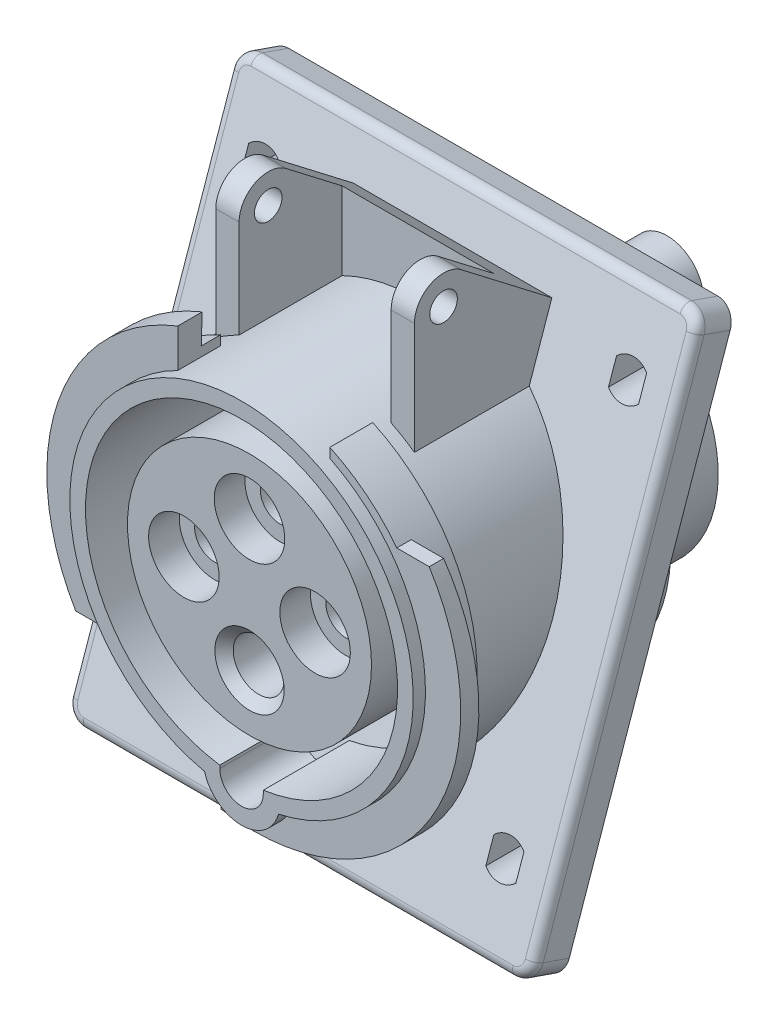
SolidWorks part; units mm, degrees
ref_plane "Спереди" through (0, 0, 0) normal (0, 0, 1) x (1, 0, 0)
ref_plane "Сверху" through (0, 0, 0) normal (0, 1, 0) x (1, 0, 0)
ref_plane "Справа" through (0, 0, 0) normal (1, 0, 0) x (0, 0, -1)
sketch "Эскиз1" plane through (0, 0, 0) normal (0, 0, 1) x (1, 0, 0)
  line L0 (-30.35, 30.35) -> (-30.35, -30.35) construction
  line L1 (-37.25, -37.25) -> (37.25, -37.25)
  line L2 (-37.25, -37.25) -> (-37.25, 37.25)
  line L3 (-37.25, 37.25) -> (37.25, 37.25)
  line L4 (37.25, -37.25) -> (37.25, 37.25)
  line L5 (-37.25, -37.25) -> (37.25, 37.25) construction
  line L6 (-37.25, 37.25) -> (37.25, -37.25) construction
  line L7 (-30.35, -30.35) -> (30.35, -30.35) construction
  line L8 (30.35, -30.35) -> (30.35, 30.35) construction
  line L9 (30.35, 30.35) -> (-30.35, 30.35) construction
  circle A0 centre (-30.35, 30.35) radius 2.4
  circle A1 centre (30.35, 30.35) radius 2.4
  circle A2 centre (30.35, -30.35) radius 2.4
  circle A3 centre (-30.35, -30.35) radius 2.4
  point P0 (0, 0)
  dimension "D3" = 4.8
  dimension "D1" = 74.5
  dimension "D2" = 74.5
  dimension "D4" = 60.7
extrude "Бобышка-Вытянуть1" add sketch "Эскиз1" along normal blind 9.8
sketch "Эскиз2" plane through (0, 0, 9.8) normal (0, 0, 1) x (1, 0, 0)
  circle A0 centre (0, 0) radius 28
  dimension "D1" = 56
extrude "Бобышка-Вытянуть2" add sketch "Эскиз2" along normal blind 40.7
sketch "Эскиз3" plane through (0, 0, 50.5) normal (0, 0, 1) x (1, 0, 0)
  circle A0 centre (0, 0) radius 25.45
  circle A1 centre (0, 0) radius 19.9
  dimension "D1" = 50.9
  dimension "D2" = 39.8
extrude "Вырез-Вытянуть1" cut sketch "Эскиз3" against normal blind 39
sketch "Эскиз4" plane through (0, 0, 50.5) normal (0, 0, 1) x (1, 0, 0)
  circle A0 centre (0, 0) radius 22.65
  dimension "D1" = 45.3
extrude "Вырез-Вытянуть2" cut sketch "Эскиз4" against normal blind 1.3
sketch "Эскиз5" plane through (0, 0, 49.2) normal (0, 0, 1) x (1, 0, 0)
  line L0 (0, 0) -> (0, -10.7) construction
  circle A0 centre (0, -10.7) radius 4.15
  circle A13 centre (0, 10.7) radius 5.75
  circle A14 centre (-10.7, 0) radius 5.75
  circle A15 centre (10.7, 0) radius 5.75
  point P15 (0, 0)
  point P18 (0, 0)
  dimension "D1" = 8.3
  dimension "D4" = 10.7
  dimension "D2" = 11.5
  dimension "D3" = 10.7
  dimension "D5" = 10.7
  dimension "D6" = 10.7
extrude "Вырез-Вытянуть3" cut sketch "Эскиз5" against normal blind 5
sketch "Эскиз6" plane through (0, 0, 44.2) normal (0, 0, 1) x (1, 0, 0)
  circle A0 centre (0, 10.7) radius 3.25
  circle A1 centre (-10.7, 0) radius 3.25
  circle A2 centre (10.7, 0) radius 3.25
  circle A4 centre (0, -10.7) radius 4.15
  dimension "D1" = 6.5
  dimension "D2" = 8.3
extrude "Вырез-Вытянуть4" cut sketch "Эскиз6" against normal blind 20
chamfer "Фаска1" distance 1.5 angle 45 1 edges at (4.15, -10.7, 49.2)
sketch "Эскиз7" plane through (0, 0, 9.8) normal (0, 0, 1) x (1, 0, 0)
  arc A0 (-6.0271, -27.3436) -> (6.0271, -27.3436) centre (0, -25.6893) ccw
  circle A4 centre (0, 0) radius 28 construction
  arc A5 (-6.0271, -27.3436) -> (6.0271, -27.3436) centre (0, 0) ccw
  point P4 (0, -31.9393)
  dimension "D1" = 12.5
extrude "Бобышка-Вытянуть3" add sketch "Эскиз7" along normal up to surface (40.7 mm away)
sketch "Эскиз8" plane through (0, 0, 50.5) normal (0, 0, 1) x (1, 0, 0)
  line L0 (-3.55, -25.6893) -> (-3.55, -25.2012)
  line L1 (3.55, -25.6893) -> (3.55, -25.2012)
  circle A1 centre (0, 0) radius 25.45 construction
  arc A2 (-3.4234, -26.629) -> (3.4234, -26.629) centre (0, -25.6893) ccw
  arc A3 (-3.55, -25.6893) -> (3.55, -25.6893) centre (0, -25.6893) ccw
  arc A4 (-3.55, -25.2012) -> (3.55, -25.2012) centre (0, 0) ccw
  dimension "D1" = 2.7
extrude "Вырез-Вытянуть5" cut sketch "Эскиз8" against normal up to surface (39 mm away)
ref_plane "Плоскость1" through (0, 0, 48.5) normal (0, 0, 1) x (1, 0, 0)
sketch "Эскиз9" plane through (0, 0, 48.5) normal (0, 0, 1) x (1, 0, 0)
  circle A0 centre (0, 0) radius 33.75
  arc A1 (-6.0271, -27.3436) -> (6.0271, -27.3436) centre (0, -25.6893) ccw construction
  arc A2 (6.0271, -27.3436) -> (-6.0271, -27.3436) centre (0, 0) ccw construction
  arc A3 (-6.0271, -27.3436) -> (6.0271, -27.3436) centre (0, -25.6893) ccw
  arc A4 (6.0271, -27.3436) -> (-6.0271, -27.3436) centre (0, 0) ccw
  dimension "D1" = 67.5
extrude "Бобышка-Вытянуть4" add sketch "Эскиз9" against normal blind 4.3
sketch "Эскиз10" plane through (0, 0, 44.2) normal (0, 0, -1) x (-1, 0, 0)
  line L0 (-3.55, -25.6893) -> (-3.55, -25.2012) construction
  line L1 (3.55, -25.2012) -> (3.55, -25.6893) construction
  line L2 (-3.55, -25.6893) -> (-3.55, -25.2012)
  line L3 (3.55, -25.2012) -> (3.55, -25.6893)
  circle A0 centre (0, 0) radius 29.4
  arc A1 (3.55, -25.2012) -> (-3.55, -25.2012) centre (0, 0) ccw
  arc A2 (-3.55, -25.6893) -> (3.55, -25.6893) centre (0, -25.6893) ccw construction
  arc A3 (-3.55, -25.6893) -> (3.55, -25.6893) centre (0, -25.6893) ccw
  dimension "D1" = 58.8
extrude "Бобышка-Вытянуть5" add sketch "Эскиз10" along normal blind 2.7
ref_plane "Плоскость2" through (0, 0, 38.5) normal (0, 0, 1) x (1, 0, 0)
sketch "Эскиз11" plane through (0, 0, 38.5) normal (0, 0, 1) x (1, 0, 0)
  line L0 (-16.2, 22.8377) -> (-16.2, 45.8)
  line L1 (-16.2, 45.8) -> (16.2, 45.8)
  line L2 (16.2, 45.8) -> (16.2, 22.8377)
  arc A0 (6.0271, -27.3436) -> (-6.0271, -27.3436) centre (0, 0) ccw construction
  arc A1 (16.2, 22.8377) -> (-16.2, 22.8377) centre (0, 0) ccw
  point P6 (0, 45.8)
  point P8 (0, 28)
  dimension "D1" = 32.4
  dimension "D2" = 17.8
extrude "Бобышка-Вытянуть6" add sketch "Эскиз11" against normal up to surface (28.7 mm away)
sketch "Эскиз12" plane through (16.2, 0, 0) normal (1, 0, 0) x (0, 0, -1)
  line L0 (-9.8, 28.65) -> (-30.8573, 44.8176)
  line L1 (-9.8, -37.25) -> (-9.8, 37.25) construction
  line L2 (-9.8, 45.8) -> (-38.5, 45.8) construction
  line L3 (-9.8, 37.25) -> (0, 37.25) construction
  line L4 (-38.5, 22.8377) -> (-38.5, 45.8) construction
  line L6 (-9.8, 37.25) -> (-9.8, 45.8) construction
  line L7 (-38.5, 41.05) -> (-38.5, 46.8)
  line L9 (-9.8, 28.65) -> (-9.8, 46.8)
  line L10 (-9.8, 46.8) -> (-38.5, 46.8)
  arc A0 (-30.8573, 44.8176) -> (-38.5, 41.05) centre (-33.75, 41.05) ccw
  dimension "D2" = 9.5
  dimension "D1" = 8.6
  dimension "D3" = 1
extrude "Вырез-Вытянуть6" cut sketch "Эскиз12" against normal up to next
ref_plane "Плоскость3" through (0, 45.8, 0) normal (0, 1, 0) x (1, 0, 0)
sketch "Эскиз13" plane through (0, 45.8, 0) normal (0, 1, 0) x (1, 0, 0)
  line L0 (-30.8, -38.5) -> (30.8, -38.5) construction
  line L1 (-12.4, -38.5) -> (12.4, -38.5)
  line L2 (-12.4, -38.5) -> (-12.4, -21.7)
  line L3 (-12.4, -21.7) -> (12.4, -21.7)
  line L4 (12.4, -38.5) -> (12.4, -21.7)
  point P6 (0, -21.7)
  dimension "D1" = 24.8
  dimension "D2" = 16.8
extrude "Вырез-Вытянуть7" cut sketch "Эскиз13" against normal up to surface (20.6954 mm away)
sketch "Эскиз14" plane through (16.2, 0, 0) normal (1, 0, 0) x (0, 0, -1)
  circle A0 centre (-33.75, 41.05) radius 2.25
  dimension "D1" = 4.5
extrude "Вырез-Вытянуть8" cut sketch "Эскиз14" against normal up to surface (32.4 mm away)
sketch "Эскиз16" plane through (0, 0, 41.5) normal (0, 0, -1) x (-1, 0, 0)
  line L0 (12.4, 25.1046) -> (12.4, 41.05) construction
  line L1 (-12.4, 25.1046) -> (-12.4, 41.05) construction
  line L2 (12.4, 25.1046) -> (12.4, 31.3895)
  line L3 (-12.4, 25.1046) -> (-12.4, 31.3895)
  circle A0 centre (0, 0) radius 33.75 construction
  arc A1 (6.0271, -27.3436) -> (-6.0271, -27.3436) centre (0, 0) ccw construction
  arc A2 (12.4, 31.3895) -> (-12.4, 31.3895) centre (0, 0) ccw
  arc A3 (12.4, 25.1046) -> (-12.4, 25.1046) centre (0, 0) ccw
extrude "Вырез-Вытянуть9" cut sketch "Эскиз16" against normal up to next
sketch "Эскиз18" plane through (0, 0, 44.2) normal (0, 0, -1) x (-1, 0, 0)
  line L0 (-23.3229, 17.8998) -> (-28.6122, 17.8998)
  line L1 (-12.4, 31.3895) -> (-12.4, 26.6571)
  line L2 (5.3577, -28.9077) -> (5.3577, -33.322)
  line L3 (29.0478, -17.1839) -> (23.8553, -17.1839)
  arc A0 (-12.4, 26.6571) -> (-5.3577, -28.9077) centre (0, 0) ccw construction
  arc A1 (-12.4, 26.6571) -> (-23.3229, 17.8998) centre (0, 0) ccw
  arc A2 (-12.4, 31.3895) -> (12.4, 31.3895) centre (0, 0) ccw construction
  arc A4 (5.3577, -28.9077) -> (12.4, 26.6571) centre (0, 0) ccw construction
  arc A5 (5.3577, -28.9077) -> (23.8553, -17.1839) centre (0, 0) ccw
  arc A6 (-12.4, 31.3895) -> (-28.6122, 17.8998) centre (0, 0) ccw
  arc A7 (5.3577, -33.322) -> (29.0478, -17.1839) centre (0, 0) ccw
  dimension "D1" = 14
  dimension "D2" = 21.9
extrude "Вырез-Вытянуть10" cut sketch "Эскиз18" against normal up to next
ref_plane "Плоскость4" through (0, -33.75, 0) normal (0, -1, 0) x (-1, 0, 0)
sketch "Эскиз19" plane through (0, -33.75, 0) normal (0, -1, 0) x (-1, 0, 0)
  line L0 (5.3577, -44.2) -> (5.3577, -46.5)
  line L1 (5.3577, -48.5) -> (5.3577, -44.2) construction
  line L2 (5.3577, -46.5) -> (0, -46.5)
  line L3 (0, -46.5) -> (0, -44.2)
  line L4 (5.3577, -44.2) -> (-33.75, -44.2) construction
  line L5 (0, -44.2) -> (5.3577, -44.2)
  line L6 (-6.0271, -50.5) -> (6.0271, -50.5) construction
  line L7 (-33.75, -48.5) -> (5.3577, -48.5) construction
  point P11 (0, -50.5)
  dimension "D1" = 2
extrude "Вырез-Вытянуть11" cut sketch "Эскиз19" against normal up to surface (1.8107 mm away)
sketch "Эскиз20" plane through (0, 0, 44.2) normal (0, 0, -1) x (-1, 0, 0)
  line L0 (0, -33.75) -> (0, -31.9393)
  line L1 (-2, -33.6907) -> (-2, -31.6107)
  arc A0 (-5.3577, -28.9077) -> (0, -31.9393) centre (0, -25.6893) ccw construction
  arc A1 (-28.6122, 17.8998) -> (0, -33.75) centre (0, 0) ccw construction
  arc A2 (-2, -31.6107) -> (0, -31.9393) centre (0, -25.6893) ccw
  arc A3 (-2, -33.6907) -> (0, -33.75) centre (0, 0) ccw
  dimension "D1" = 2
extrude "Бобышка-Вытянуть7" add sketch "Эскиз20" along normal up to surface (2.7 mm away)
ref_plane "Плоскость5" through (0, -0.3657, 11.0236) normal (0, -0.0332, 0.9995) x (1, 0, 0)
ref_plane "Плоскость6" through (0, -1.5095, 45.5046) normal (0, -0.0332, 0.9995) x (1, 0, 0)
sketch "Эскиз22" plane through (0, 0, 44.2) normal (0, 0, -1) x (-1, 0, 0)
  line L2 (-2, -33.6907) -> (-2, -31.6107)
  line L3 (-23.3229, 17.8998) -> (-28.6122, 17.8998)
  line L4 (-2, -33.6907) -> (-2, -31.6107)
  line L5 (-23.3229, 17.8998) -> (-28.6122, 17.8998)
  arc A3 (-5.3577, -28.9077) -> (-2, -31.6107) centre (0, -25.6893) ccw
  arc A4 (-23.3229, 17.8998) -> (-5.3577, -28.9077) centre (0, 0) ccw
  arc A5 (-28.6122, 17.8998) -> (-2, -33.6907) centre (0, 0) ccw
  arc A6 (-5.3577, -28.9077) -> (-2, -31.6107) centre (0, -25.6893) ccw
  arc A7 (-23.3229, 17.8998) -> (-5.3577, -28.9077) centre (0, 0) ccw
  arc A8 (-28.6122, 17.8998) -> (-2, -33.6907) centre (0, 0) ccw
  dimension "D1" = 0
extrude "Вырез-Вытянуть13" cut sketch "Эскиз22" against normal up to surface (1.9485 mm away)
ref_plane "Плоскость7" through (0, 0.3657, 11.0236) normal (0, 0.0332, 0.9995) x (-1, 0, 0)
ref_plane "Плоскость8" through (0, 1.5095, 45.5046) normal (0, 0.0332, 0.9995) x (-1, 0, 0)
sketch "Эскиз23" plane through (0, 0, 44.2) normal (0, 0, -1) x (-1, 0, 0)
  line L2 (23.8553, -17.1839) -> (29.0478, -17.1839)
  line L3 (12.4, 31.3895) -> (12.4, 26.6571)
  line L4 (23.8553, -17.1839) -> (29.0478, -17.1839)
  line L5 (12.4, 31.3895) -> (12.4, 26.6571)
  arc A2 (23.8553, -17.1839) -> (12.4, 26.6571) centre (0, 0) ccw
  arc A3 (29.0478, -17.1839) -> (12.4, 31.3895) centre (0, 0) ccw
  arc A4 (23.8553, -17.1839) -> (12.4, 26.6571) centre (0, 0) ccw
  arc A5 (29.0478, -17.1839) -> (12.4, 31.3895) centre (0, 0) ccw
  dimension "D1" = 0
extrude "Вырез-Вытянуть14" cut sketch "Эскиз23" against normal up to surface (1.9247 mm away)
fillet "Скругление1" radius 3 4 edges at (-37.25, 37.25, 4.9) (-37.25, -37.25, 4.9) (37.25, -37.25, 4.9) (37.25, 37.25, 4.9)
fillet "Скругление2" radius 1.5 8 edges at (-36.3713, 36.3713, 9.8) (0, 37.25, 9.8) (36.3713, 36.3713, 9.8) (37.25, 0, 9.8) (36.3713, -36.3713, 9.8) (0, -37.25, 9.8) (-36.3713, -36.3713, 9.8) (-37.25, 0, 9.8)
sketch "Эскиз24" plane through (0, 0, 0) normal (0, 0, -1) x (-1, 0, 0)
  circle A0 centre (0, 0) radius 22.75
  dimension "D1" = 45.5
extrude "Вырез-Вытянуть15" cut sketch "Эскиз24" against normal blind 8.5
ref_plane "Плоскость9" through (0, 6.884, 19.824) normal (0, 0.328, 0.9447) x (-1, 0, 0)
ref_plane "Плоскость10" through (0, 0, 19.5) normal (0, 0, -1) x (-1, 0, 0)
ref_plane "Плоскость12" through (0, 0, 0) normal (1, 0, 0) x (0, 0, -1)
sketch "Эскиз31" plane through (0, 0, 0) normal (1, 0, 0) x (0, 0, -1)
  line L0 (-13.4854, 40.9487) -> (-41.6971, -40.2923)
  line L5 (-41.5, -27.3436) -> (-41.5, 25.1046) construction
  line L6 (-13.4854, 40.9487) -> (-7.8174, 38.9804)
  line L7 (-7.8174, 38.9804) -> (-36.0291, -42.2606)
  line L8 (-50.5, 28) -> (-50.5, -27.3436) construction
  line L9 (-36.0291, -42.2606) -> (-41.6971, -40.2923)
  point P4 (-27.5912, 0.3282)
  point P18 (-50.5, 0.3282)
  dimension "D1" = 19.15
  dimension "D2" = 86
  dimension "D3" = 6
  dimension "D4" = 22.9088
extrude "Бобышка-Вытянуть12" add sketch "Эскиз31" along normal mid plane 76
sketch "Эскиз32" plane through (0, 0, 9.8) normal (0, 0, 1) x (1, 0, 0)
  line L0 (-34.25, 37.25) -> (34.25, 37.25) construction
  line L1 (-37.25, -37.25) -> (37.25, -37.25)
  line L2 (-37.25, -37.25) -> (-37.25, 37.25)
  line L3 (-37.25, 37.25) -> (37.25, 37.25)
  line L4 (37.25, -37.25) -> (37.25, 37.25)
  line L5 (-37.25, -37.25) -> (37.25, 37.25) construction
  line L6 (-37.25, 37.25) -> (37.25, -37.25) construction
  line L7 (37.25, 34.25) -> (37.25, -34.25) construction
  point P0 (0, 0)
extrude "Вырез-Вытянуть19" cut sketch "Эскиз32" against normal up to surface (9.8 mm away)
sketch "Эскиз33" plane through (0, 6.6173, 19.0558) normal (0, -0.328, -0.9447) x (-1, 0, 0)
  line L0 (37.25, 32.4271) -> (37.25, 28.2153) construction
  line L1 (-37.25, 32.4271) -> (37.25, 32.4271) construction
  line L2 (37.25, 28.2153) -> (-37.25, 28.2153) construction
  line L3 (-37.25, 28.2153) -> (-37.25, 32.4271) construction
  line L4 (37.25, 32.4271) -> (37.25, 28.2153)
  line L5 (-37.25, 32.4271) -> (37.25, 32.4271)
  line L6 (37.25, 28.2153) -> (-37.25, 28.2153)
  line L7 (-37.25, 28.2153) -> (-37.25, 32.4271)
extrude "Бобышка-Вытянуть13" add sketch "Эскиз33" against normal up to surface (1.4626 mm away)
sketch "Эскиз34" plane through (0, 0, 9.8) normal (0, 0, -1) x (-1, 0, 0)
  line L0 (16.2, 22.8377) -> (16.2, 29.6228) construction
  line L1 (-16.2, 29.6228) -> (16.2, 29.6228) construction
  line L2 (-16.2, 29.6228) -> (-16.2, 22.8377) construction
  line L3 (16.2, 22.8377) -> (16.2, 29.6228)
  line L4 (-16.2, 29.6228) -> (16.2, 29.6228)
  line L5 (-16.2, 29.6228) -> (-16.2, 22.8377)
  arc A0 (16.2, 22.8377) -> (-16.2, 22.8377) centre (0, 0) ccw
extrude "Вырез-Вытянуть20" cut sketch "Эскиз34" against normal up to surface (3.6232 mm away)
sketch "Эскиз35" plane through (0, 0, 9.8) normal (0, 0, -1) x (-1, 0, 0)
  arc A2 (-6.0271, -27.3436) -> (6.0271, -27.3436) centre (0, -25.6893) ccw
  arc A3 (6.0271, -27.3436) -> (-6.0271, -27.3436) centre (0, 0) ccw
  arc A4 (-6.0271, -27.3436) -> (6.0271, -27.3436) centre (0, -25.6893) ccw
  arc A5 (6.0271, -27.3436) -> (-6.0271, -27.3436) centre (0, 0) ccw
  dimension "D1" = 0
extrude "Бобышка-Вытянуть14" add sketch "Эскиз35" along normal blind 1.3
sketch "Эскиз36" plane through (0, 0, 8.5) normal (0, 0, -1) x (-1, 0, 0)
  circle A0 centre (0, 0) radius 21.25
  dimension "D1" = 42.5
extrude "Бобышка-Вытянуть15" add sketch "Эскиз36" along normal blind 14.5
sketch "Эскиз37" plane through (0, 0, -6) normal (0, 0, -1) x (-1, 0, 0)
  line L0 (-5.9018, 9.9442) -> (-4.75, 0.95)
  line L1 (-4.75, 0.95) -> (-3.6277, 0.95)
  line L2 (4.75, 0.95) -> (5.9018, 9.9442)
  line L3 (3.6277, 0.95) -> (4.75, 0.95)
  arc A0 (5.9018, 9.9442) -> (-5.9018, 9.9442) centre (0, 10.7) ccw
  arc A2 (3.6277, 0.95) -> (-3.6277, 0.95) centre (0, 0) ccw
  dimension "D1" = 11.9
  dimension "D2" = 9.75
  dimension "D4" = 7.5
  dimension "D3" = 9.5
extrude "Бобышка-Вытянуть16" add sketch "Эскиз37" along normal blind 12.9
sketch "Эскиз38" plane through (0, 0, -6) normal (0, 0, -1) x (-1, 0, 0)
  line L0 (-5.8192, -11.3) -> (-4.85, -20.7)
  line L1 (5.8192, -11.3) -> (4.85, -20.7)
  line L2 (0, 0) -> (0, -10.7) construction
  line L3 (-4.85, -20.7) -> (4.85, -20.7)
  arc A0 (5.8192, -11.3) -> (-5.8192, -11.3) centre (0, -10.7) ccw
  point P4 (0, -20.7)
  dimension "D1" = 11.7
  dimension "D2" = 10
  dimension "D3" = 9.7
extrude "Бобышка-Вытянуть17" add sketch "Эскиз38" along normal blind 4
sketch "Эскиз39" plane through (0, 0, -18.9) normal (0, 0, -1) x (-1, 0, 0)
  circle A0 centre (0, 10.7) radius 2.2
  dimension "D1" = 4.4
extrude "Вырез-Вытянуть21" cut sketch "Эскиз39" against normal blind 10
sketch "Эскиз40" plane through (0, 0, -10) normal (0, 0, -1) x (-1, 0, 0)
  circle A0 centre (0, -10.7) radius 2.2
  dimension "D1" = 4.4
extrude "Вырез-Вытянуть22" cut sketch "Эскиз40" against normal blind 10
sketch "Эскиз41" plane through (0, 0, -6) normal (0, 0, -1) x (-1, 0, 0)
  circle A0 centre (-10.7, 0) radius 2.2
  circle A1 centre (10.7, 0) radius 2.2
  dimension "D1" = 4.4
extrude "Вырез-Вытянуть23" cut sketch "Эскиз41" against normal blind 10
sketch "Эскиз42" plane through (0, 0, -10) normal (0, 0, -1) x (-1, 0, 0)
  line L0 (-0.15, -14.3862) -> (0.15, -14.3862)
  line L1 (-0.15, -14.3862) -> (-0.15, -17.3862)
  line L2 (0.15, -14.3862) -> (0.15, -17.3862)
  line L3 (0.15, -17.3862) -> (3.2, -17.3862)
  line L4 (-3.2, -17.3862) -> (-0.15, -17.3862)
  line L5 (-3.2, -17.3862) -> (-3.2, -17.6862)
  line L6 (-3.2, -17.6862) -> (3.2, -17.6862)
  line L7 (3.2, -17.3862) -> (3.2, -17.6862)
  line L16 (-1.95, -18.4862) -> (1.95, -18.4862)
  line L17 (-1.95, -18.4862) -> (-1.95, -18.7862)
  line L18 (-1.95, -18.7862) -> (1.95, -18.7862)
  line L19 (1.95, -18.4862) -> (1.95, -18.7862)
  line L20 (-1.05, -19.5862) -> (1.05, -19.5862)
  line L21 (-1.05, -19.5862) -> (-1.05, -19.8862)
  line L22 (-1.05, -19.8862) -> (1.05, -19.8862)
  line L23 (1.05, -19.5862) -> (1.05, -19.8862)
  point P4 (0, -14.3862)
  point P13 (0, -18.4862)
  point P14 (0, -17.6862)
  point P15 (0, -19.5862)
  point P20 (0, -18.7862)
  dimension "D1" = 0.3
  dimension "D2" = 3
  dimension "D3" = 6.4
  dimension "D4" = 0.3
  dimension "D5" = 0.3
  dimension "D6" = 3.9
  dimension "D7" = 0.8
  dimension "D8" = 0.3
  dimension "D9" = 2.1
  dimension "D10" = 0.8
extrude "Бобышка-Вытянуть19" add sketch "Эскиз42" along normal blind 0.1
sketch "Эскиз43" plane through (0, 0, -18.9) normal (0, 0, -1) x (-1, 0, 0)
  text T0 "L2" font "Arial" height 2.5
extrude "Бобышка-Вытянуть20" add sketch "Эскиз43" along normal blind 0.1
sketch "Эскиз44" plane through (0, 0, -6) normal (0, 0, -1) x (-1, 0, 0)
  text T0 "L1" font "Arial" height 2.5
  text T1 "L3" font "Arial" height 2.5
  point P2 (0, 0)
extrude "Бобышка-Вытянуть21" add sketch "Эскиз44" along normal blind 0.1
sketch "Эскиз45" plane through (0, 0, -6) normal (0, 0, -1) x (-1, 0, 0)
  circle A0 centre (0, 0) radius 3.75
extrude "Вырез-Вытянуть24" cut sketch "Эскиз45" against normal blind 12
fillet "Скругление3" radius 3 4 edges at (-38, -41.2765, 38.8631) (38, -41.2765, 38.8631) (-38, 39.9646, 10.6514) (38, 39.9646, 10.6514)
fillet "Скругление4" radius 1.5 8 edges at (-37.1213, 40.1186, 13.7737) (0, 40.9487, 13.4854) (37.1213, 40.1186, 13.7737) (38, 0.3282, 27.5912) (37.1213, -39.4623, 41.4088) (0, -40.2923, 41.6971) (-37.1213, -39.4623, 41.4088) (-38, 0.3282, 27.5912)
sketch "Эскиз46" plane through (0, 8.5856, 24.7238) normal (0, 0.328, 0.9447) x (1, 0, 0)
  line L0 (-35, 34.2589) -> (35, 34.2589) construction
  line L3 (-32.5, 22.0597) -> (-27.6026, 22.0597) construction
  line L5 (-32.5, 24.0597) -> (-32.5, 20.0597)
  line L7 (-27.6026, 24.0597) -> (-27.6026, 20.0597)
  line L8 (-38, -48.7411) -> (-38, 31.2589) construction
  arc A2 (-32.5, 24.0597) -> (-27.6026, 24.0597) centre (-30.0513, 21.5589) cw
  arc A3 (-32.5, 20.0597) -> (-27.6026, 20.0597) centre (-30.0513, 22.5605) ccw
  point P0 (-48.7618, 25.5982)
  point P1 (-30.0513, 22.0597)
  point P9 (-30.0513, 25.0589)
  point P10 (-30.0513, 19.0605)
  point P11 (-52.9277, 22.1818)
  dimension "D4" = 3.5
  dimension "D1" = 4
  dimension "D2" = 9.2
  dimension "D3" = 5.9985
  dimension "D5" = 5.5
sketch "Эскиз47" plane through (-38, 0, 0) normal (-1, 0, 0) x (0, 0, 1)
  line L0 (17.4873, 29.4245) -> (11.1358, 29.4245)
  line L1 (16.8312, 31.3139) -> (18.1434, 27.5352) construction
  line L2 (35.045, -39.4266) -> (8.8016, 36.1464) construction
sweep "Вырез-По траектории1" cut profiles "Эскиз46" path "Эскиз47"
pattern_linear "Линейный массив1" count 2 spacing 61 along (0, -0.9447, 0.328) count 2 spacing 60 along (-1, 0, 0) of "Вырез-По траектории1"
